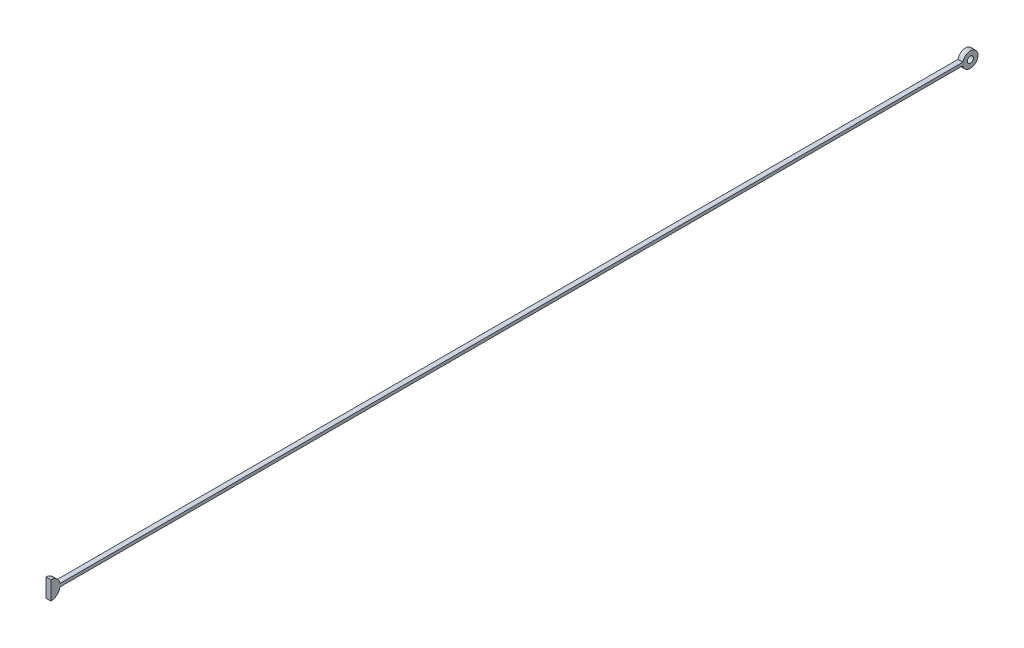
SolidWorks part; units mm, degrees
ref_plane "Front Plane" through (0, 0, 0) normal (0, 0, 1) x (1, 0, 0)
ref_plane "Top Plane" through (0, 0, 0) normal (0, 1, 0) x (1, 0, 0)
ref_plane "Right Plane" through (0, 0, 0) normal (1, 0, 0) x (0, 0, -1)
sketch "Sketch1" plane through (0, 0, 0) normal (1, 0, 0) x (0, 0, -1)
  line L0 (-1500, 15) -> (-1500, -15)
  line L1 (-1485.2098, 2.5) -> (-12.2474, 2.5)
  line L3 (-1485.2098, -2.5) -> (-12.2474, -2.5)
  arc A0 (-12.2474, -2.5) -> (-12.2474, 2.5) centre (0, 0) ccw
  arc A1 (-1500, -15) -> (-1485.2098, -2.5) centre (-1500, 0) ccw
  arc A2 (-1485.2098, 2.5) -> (-1500, 15) centre (-1500, 0) ccw
  circle A3 centre (0, 0) radius 5
  dimension "D1" = 25
  dimension "D4" = 15
  dimension "D6" = 10
  dimension "D2" = 2.5
  dimension "D3" = 5
  dimension "D5" = 2.5
  dimension "D7" = 1500
extrude "Boss-Extrude1" add sketch "Sketch1" along normal blind 8
